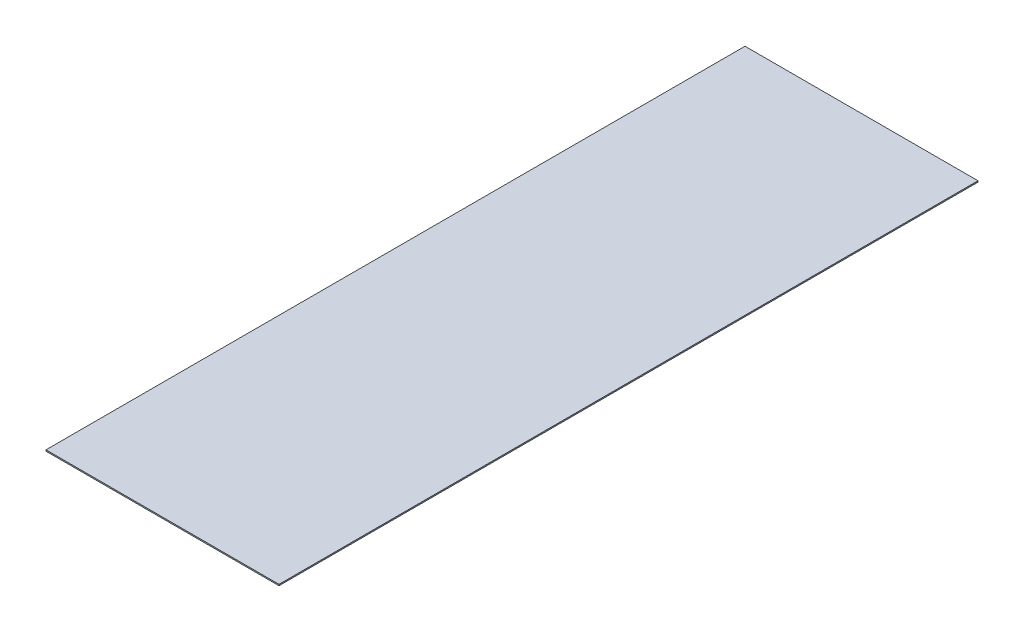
SolidWorks part; units mm, degrees
ref_plane "Front Plane" through (0, 0, 0) normal (0, 0, 1) x (1, 0, 0)
ref_plane "Top Plane" through (0, 0, 0) normal (0, 1, 0) x (1, 0, 0)
ref_plane "Right Plane" through (0, 0, 0) normal (1, 0, 0) x (0, 0, -1)
sketch "Sketch1" plane through (0, 0, 0) normal (0, 1, 0) x (1, 0, 0)
  line L0 (-47.625, 0) -> (0, 0)
  line L2 (0, 0) -> (0, -142.875)
  line L3 (0, -142.875) -> (-47.625, -142.875)
  line L4 (-47.625, 0) -> (-47.625, -142.875)
  dimension "D1" = 142.875
  dimension "D2" = 47.625
extrude "Boss-Extrude1" add sketch "Sketch1" along normal blind 0.254
